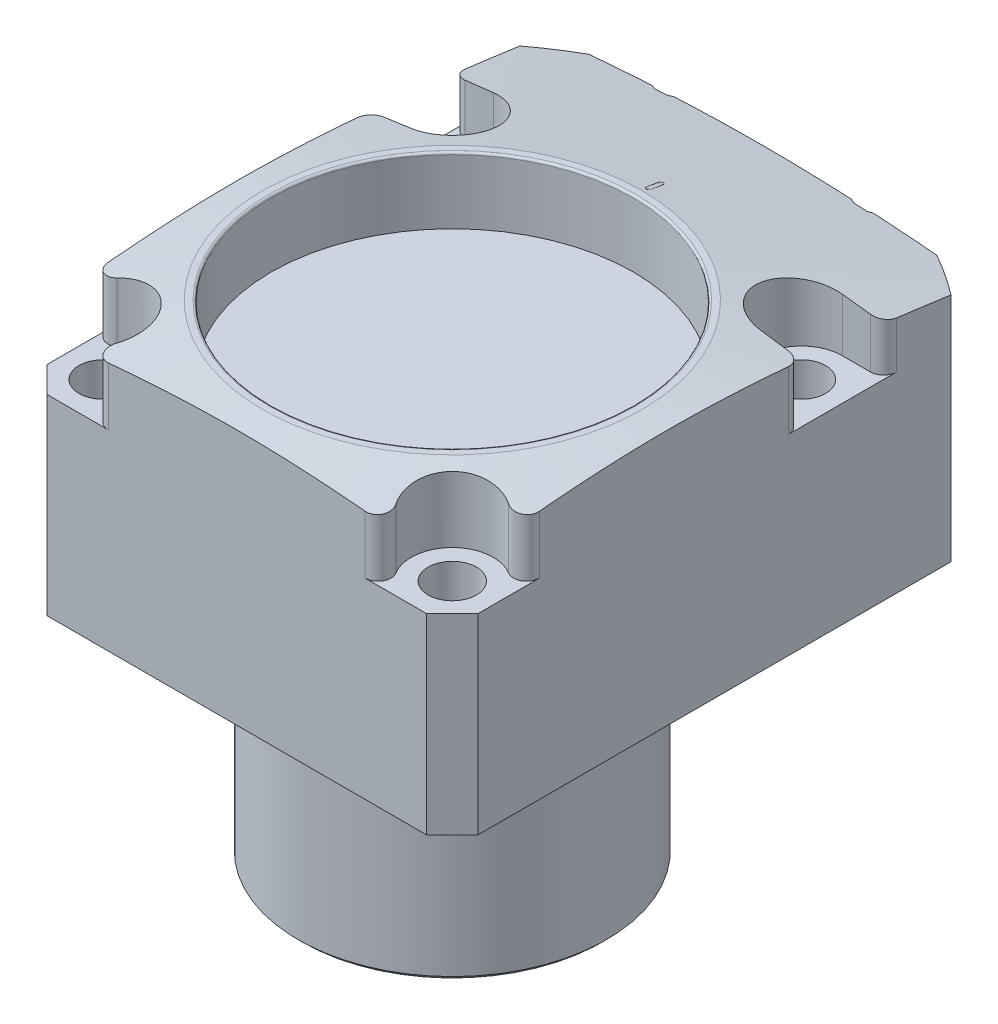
SolidWorks part; units mm, degrees
ref_plane "Front Plane" through (0, 0, 0) normal (0, 0, 1) x (1, 0, 0)
ref_plane "Top Plane" through (0, 0, 0) normal (0, 1, 0) x (1, 0, 0)
ref_plane "Right Plane" through (0, 0, 0) normal (1, 0, 0) x (0, 0, -1)
sketch "Sketch6" plane through (0, 0, 0) normal (0, 0, 1) x (1, 0, 0)
  line L0 (0, -8.9689) -> (0, 71.3762) construction
  line L1 (21.0185, 30.2006) -> (21.9964, 30.2006)
  line L2 (21.9964, 30.2006) -> (41.275, 26.8013)
  line L3 (41.275, 26.8013) -> (41.275, 0)
  line L4 (41.275, 0) -> (17.8816, 0)
  line L5 (17.8816, 0) -> (17.8816, -25.6032)
  line L6 (17.8816, -25.6032) -> (0, -25.6032)
  line L7 (0, -25.6032) -> (0, 22.5044)
  line L8 (21.0185, 30.2006) -> (21.0185, 22.5044)
  line L9 (21.0185, 22.5044) -> (0, 22.5044)
  dimension "D1" = 35.7632
  dimension "D2" = 30.2006
  dimension "D3" = 25.6032
  dimension "D4" = 82.55
  dimension "D5" = 10
  dimension "D6" = 43.9928
  dimension "D7" = 7.6962
  dimension "D8" = 42.037
  dimension "D9" = 55.8038
revolve "Revolve3" add sketch "Sketch6" angle 360 about L0
fillet "Fillet7" radius 0.25 1 edges at (0, 30.2006, -21.0185)
sketch "Sketch7" plane through (0, 0, 0) normal (0, -1, 0) x (1, 0, 0)
  line L0 (0, 0) -> (0, -52.3237) construction
  line L1 (-25.0038, 25.0038) -> (25.0038, 25.0038)
  line L2 (-25.0038, 25.0038) -> (-25.0038, -36.007)
  line L3 (-25.0038, -36.007) -> (25.0038, -36.007)
  line L4 (25.0038, 25.0038) -> (25.0038, -36.007)
  dimension "D1" = 50.0075
  dimension "D2" = 61.0108
  dimension "D3" = 25.0038
  dimension "D4" = 36.007
  dimension "D5" = 25.0038
extrude "Cut-Extrude5" cut sketch "Sketch7" against normal through all flip side to cut
sketch "Sketch8" plane through (0, 0, 0) normal (0, -1, 0) x (1, 0, 0)
  circle A0 centre (-20.2438, 20.2438) radius 2.8067
  dimension "D1" = 5.6134
  dimension "D2" = 20.2438
  dimension "D3" = 20.2438
extrude "Cut-Extrude6" cut sketch "Sketch8" against normal through all
pattern_circular "CirPattern2" count 4 over 360 about axis through (0, 0, 0) along (0, 1, 0) of "Cut-Extrude6"
chamfer "Chamfer1" distance 3 angle 45 2 edges at (-25.0038, 13.9221, 25.0038) (25.0038, 13.9221, 25.0038)
sketch "Sketch9" plane through (0, 30.2006, 0) normal (0, 1, 0) x (1, 0, 0)
  line L0 (-25.0038, -22.0038) -> (-22.0038, -25.0038) construction
  line L1 (-22.0038, -25.0038) -> (22.0038, -25.0038) construction
  line L2 (25.0038, 25.0063) -> (25.0038, 15.4813)
  line L3 (-25.0038, -22.0038) -> (-22.0038, -25.0038)
  line L4 (25.0038, 15.4813) -> (20.2438, 15.4813)
  line L5 (20.2438, 25.0063) -> (25.0038, 25.0063)
  line L6 (-20.2438, 25.0063) -> (-25.0038, 25.0063)
  line L7 (-25.0038, 32.8396) -> (-25.0038, -22.0038) construction
  line L8 (-25.0038, 15.4813) -> (-20.2438, 15.4813)
  line L9 (-25.0038, 25.0063) -> (-25.0038, 15.4813)
  line L10 (-22.0038, -25.0038) -> (-18.2686, -25.0038)
  line L11 (0, 0) -> (0, 26.6366) construction
  line L13 (-25.0038, -18.2686) -> (-23.6114, -16.8762)
  line L14 (-16.8762, -23.6114) -> (-18.2686, -25.0038)
  line L15 (-25.0038, -18.2686) -> (-25.0038, -22.0038)
  line L16 (25.0038, -18.2686) -> (25.0038, -22.0038)
  line L17 (16.8762, -23.6114) -> (18.2686, -25.0038)
  line L18 (25.0038, -18.2686) -> (23.6114, -16.8762)
  line L19 (22.0038, -25.0038) -> (18.2686, -25.0038)
  line L20 (25.0038, -22.0038) -> (22.0038, -25.0038)
  arc A0 (-16.8762, -23.6114) -> (-23.6114, -16.8762) centre (-20.2438, -20.2438) ccw
  arc A1 (-20.2438, 15.4813) -> (-20.2438, 25.0063) centre (-20.2438, 20.2438) ccw
  arc A2 (16.8762, -23.6114) -> (23.6114, -16.8762) centre (20.2438, -20.2438) cw
  arc A3 (20.2438, 15.4813) -> (20.2438, 25.0063) centre (20.2438, 20.2438) cw
  dimension "D1" = 9.525
extrude "Cut-Extrude7" cut sketch "Sketch9" against normal offset from surface (7.9756 mm away) 22.225
fillet "Fillet4" radius 1.5 8 edges at (-25.0038, 25.5593, -15.4813) (25.0038, 25.0344, -25.0063) (25.0038, 25.5593, -15.4813) (25.0038, 25.422, 18.2686) (18.2686, 25.422, 25.0038) (-18.2686, 25.422, 25.0038) (-25.0038, 25.422, 18.2686) (-25.0038, 25.0344, -25.0063)
fillet "Fillet5" radius 0.4 1 edges at (0, 0, -17.8816)
chamfer "Chamfer2" distance 0.5 angle 45 1 edges at (0, -25.6032, -17.8816)
ref_plane "Plane1" through (0, 17.018, 0) normal (0, -1, 0) x (1, 0, 0)
sketch "Sketch11" plane through (0, 17.018, 0) normal (0, -1, 0) x (1, 0, 0)
  line L0 (-10.9982, -4.7006) -> (-10.9982, -58.3255) construction
  line L1 (-20.1772, -36.007) -> (20.1772, -36.007) construction
  line L2 (-17.1831, -35.753) -> (-16.6378, -33.1876)
  line L3 (-16.6378, -33.1876) -> (-15.9766, -32.5264)
  line L10 (-10.9982, -36.007) -> (-21.4757, -36.007)
  line L11 (-10.9982, -21.021) -> (-10.9982, -36.007)
  line L12 (-15.9766, -21.021) -> (-10.9982, -21.021)
  line L13 (-15.9766, -32.5264) -> (-15.9766, -21.021)
  line L15 (-21.4757, -35.753) -> (-17.1831, -35.753)
  line L16 (-21.4757, -36.007) -> (-21.4757, -35.753)
  dimension "D1" = 10.9982
  dimension "D2" = 0.254
  dimension "D3" = 14.732
  dimension "D4" = 9.9568
  dimension "D5" = 20.955
  dimension "D6" = 12
  dimension "D7" = 2.5654
  dimension "D8" = 45
  dimension "D9" = 12.3698
revolve "Cut-Revolve5" cut sketch "Sketch11" angle 360 about L0
ref_plane "Plane2" through (0, 0, -27.7622) normal (0, 0, 1) x (1, 0, 0)
sketch "Sketch13" plane through (0, 0, -27.7622) normal (0, 0, 1) x (1, 0, 0)
  line L0 (-14.4544, 17.7546) -> (-14.4544, 5.5009)
  line L1 (-15.572, 2.7432) -> (-15.1293, 4.826)
  line L2 (-15.572, 2.7432) -> (-16.6261, 2.7432)
  line L3 (-16.6261, 2.7432) -> (-16.6261, 0)
  line L4 (-18.2816, 0) -> (18.2816, 0) construction
  line L5 (-16.6261, 0) -> (-11, 0)
  line L6 (-11, 0) -> (-11, 17.7546)
  line L7 (-11, 17.7546) -> (-14.4544, 17.7546)
  line L8 (-11, 15.2099) -> (-11, -4.3918) construction
  line L9 (-15.1293, 4.826) -> (-14.4544, 5.5009)
  line L10 (-15.572, 2.7432) -> (-11, 2.7432) construction
  dimension "D1" = 11
  dimension "D2" = 6.9088
  dimension "D3" = 15.0114
  dimension "D4" = 2.7432
  dimension "D5" = 11.2522
  dimension "D6" = 12
  dimension "D7" = 2.0828
  dimension "D8" = 45
  dimension "D9" = 9.144
revolve "Cut-Revolve6" cut sketch "Sketch13" angle 360 about L8
sketch "Sketch1" plane through (-3.5242, 0.1824, -27.7622) normal (0, 0, 1) x (1, 0, 0)
  line L0 (-7.4758, 0) -> (-7.4758, 50000) construction
  line L1 (-5.8883, 7.971) -> (-3.6023, 7.971)
  line L2 (-3.6023, 7.971) -> (-3.6023, 5.0746)
  line L3 (-3.5642, 2.5608) -> (50000, 2.5608) construction
  line L4 (-4.4786, 4.161) -> (-4.4786, 3.4752)
  line L5 (-3.5642, 2.5608) -> (-2.0148, 2.5608)
  line L6 (-2.0148, 2.5608) -> (-2.0148, 1.1384)
  line L7 (-2.0148, 1.1384) -> (-2.6928, 1.1384)
  line L8 (-4.8088, 1.1384) -> (-4.8088, 0.0208)
  line L9 (-4.8088, 0.0208) -> (-5.8883, 0.0208)
  line L10 (-5.8883, 0.0208) -> (-5.8883, 7.971)
  line L11 (-1000, 2.5608) -> (-5.8883, 2.5608) construction
  line L12 (-3.1147, 1.1384) -> (-4.8088, 1.1384)
  arc A0 (-3.6023, 5.0746) -> (-4.4786, 4.161) centre (-3.5642, 4.161) ccw
  arc A1 (-4.4786, 3.4752) -> (-3.5642, 2.5608) centre (-3.5642, 3.4752) ccw
  arc A2 (-3.1147, 1.1384) -> (-2.6928, 1.1384) centre (-2.9038, 0.2748) ccw
  dimension "D8" = 1.6002
  dimension "D9" = 0.9144
  dimension "D10" = 7.9502
  dimension "D11" = 1.778
  dimension "D1" = 7.747
  dimension "D2" = 5.9944
  dimension "D3" = 10.922
  dimension "D4" = 5.334
  dimension "D5" = 3.175
  dimension "D6" = 1.4224
  dimension "D7" = 2.54
  dimension "D12" = 0.8636
revolve "Revolve1" add sketch "Sketch1" angle 360 about L0
sketch "Sketch2" plane through (-11, 0.2032, -28) normal (0, -1, 0) x (0, 0, 1)
  line L0 (0.2378, 0) -> (0.2378, 50000) construction
  line L1 (0.2378, 1.8331) -> (1.8253, 0.9165)
  line L2 (1.8253, 0.9165) -> (1.8253, -0.9165)
  line L3 (1.8253, -0.9165) -> (0.2378, -1.8331)
  line L4 (0.2378, -1.8331) -> (-1.3497, -0.9165)
  line L5 (-1.3497, -0.9165) -> (-1.3497, 0.9165)
  line L6 (-1.3497, 0.9165) -> (0.2378, 1.8331)
  circle A0 centre (0.2378, 0) radius 1.5875 construction
  dimension "D1" = 3.175
extrude "Cut-Extrude1" cut sketch "Sketch2" against normal up to surface (7.9502 mm away)
other "PORT_ADTAPTER<1>"
mirror "Mirror4" about plane through (0, 0, 0) normal (1, 0, 0) of "Revolve1", "Cut-Extrude1", "Cut-Revolve6", "Cut-Revolve5"
sketch "Sketch17" plane through (0, 0, 0) normal (1, 0, 0) x (0, 0, -1)
  line L0 (22.4538, 30.8917) -> (25.4662, 30.3605) construction
  line L1 (36.007, 27.7301) -> (21.9964, 30.2006) construction
  line L2 (22.4888, 30.1138) -> (24.4584, 29.7665) construction
  line L3 (22.8668, 30.8189) -> (24.3444, 30.5583) construction
  line L5 (22.7279, 30.031) -> (24.2055, 29.7705)
  line L6 (22.0789, 30.9578) -> (25.1322, 30.4194)
  arc A0 (22.0789, 30.9578) -> (22.7279, 30.031) centre (22.8668, 30.8189) ccw
  arc A1 (24.2055, 29.7705) -> (25.1322, 30.4194) centre (24.3444, 30.5583) ccw
  dimension "D1" = 0.8
  dimension "D2" = 0.76
  dimension "D3" = 2
  dimension "D4" = 0.5
  dimension "D5" = 0.04
revolve "Cut-Revolve7" cut sketch "Sketch17" angle 360 about L0
